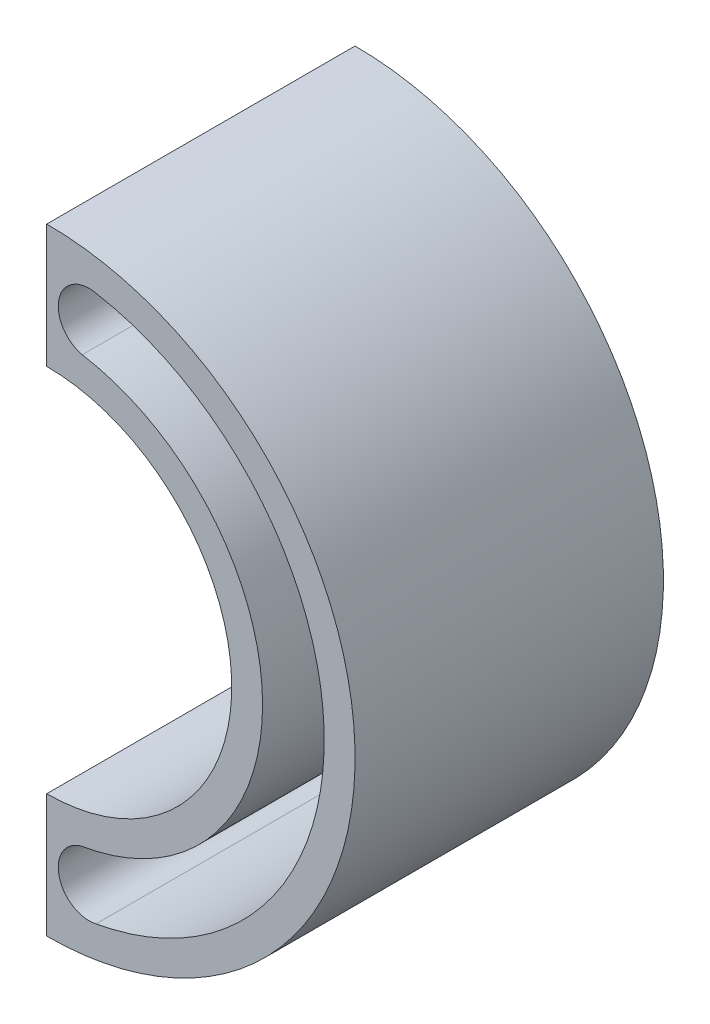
SolidWorks part; units mm, degrees
ref_plane "Ebene vorne" through (0, 0, 0) normal (0, 0, 1) x (1, 0, 0)
ref_plane "Ebene oben" through (0, 0, 0) normal (0, 1, 0) x (1, 0, 0)
ref_plane "Ebene rechts" through (0, 0, 0) normal (1, 0, 0) x (0, 0, -1)
sketch "Skizze1" plane through (0, 0, 0) normal (0, 0, 1) x (1, 0, 0)
  line L0 (0, 50) -> (0, -50)
  arc A0 (0, 50) -> (0, -50) centre (0, 0) cw
  dimension "D1" = 50
  dimension "D2" = 100
extrude "Linear austragen1" add sketch "Skizze1" along normal blind 50
sketch "Skizze2" plane through (0, 0, 50) normal (0, 0, 1) x (1, 0, 0)
  line L0 (0, 50) -> (0, -50) construction
  line L1 (0, 30) -> (0, -30)
  arc A0 (0, 40) -> (0, -40) centre (0, 0) cw
  arc A1 (0, -45) -> (0, 45) centre (0, 0) ccw
  arc A2 (0, 30) -> (0, -30) centre (0, 0) cw
  dimension "D1" = 40
extrude "Schnitt-Linear austragen1" cut sketch "Skizze2" against normal blind 50 contours A2 M2
sketch "Skizze3" plane through (0, 0, 50) normal (0, 0, 1) x (1, 0, 0)
  arc A0 (8, 44.2832) -> (8, -44.2832) centre (0, 0) cw
  arc A1 (5.7571, 34.5233) -> (5.7571, -34.5233) centre (0, 0) cw
  arc A2 (8, -44.2832) -> (5.7571, -34.5233) centre (6.8785, -39.4032) cw
  arc A3 (5.7571, 34.5233) -> (8, 44.2832) centre (6.8785, 39.4032) cw
  dimension "D1" = 5.0072
  dimension "D2" = 45
  dimension "D3" = 35
  dimension "D5" = 5.0072
  dimension "D4" = 8
extrude "Schnitt-Linear austragen2" cut sketch "Skizze3" against normal blind 50
sketch "Skizze4" plane through (0, 0, 0) normal (0, 0, 1) x (1, 0, 0)
  line L0 (0, 50) -> (0, 30) construction
  line L1 (0, -30) -> (0, -50) construction
  arc A0 (0, 40) -> (0, -40) centre (0, 0) cw
sketch "Skizze5" plane through (0, 0, 50) normal (0, 0, 1) x (1, 0, 0)
  line L0 (0, -30) -> (0, -50) construction
  arc A0 (0, 40) -> (0, -40) centre (0, 0) cw
